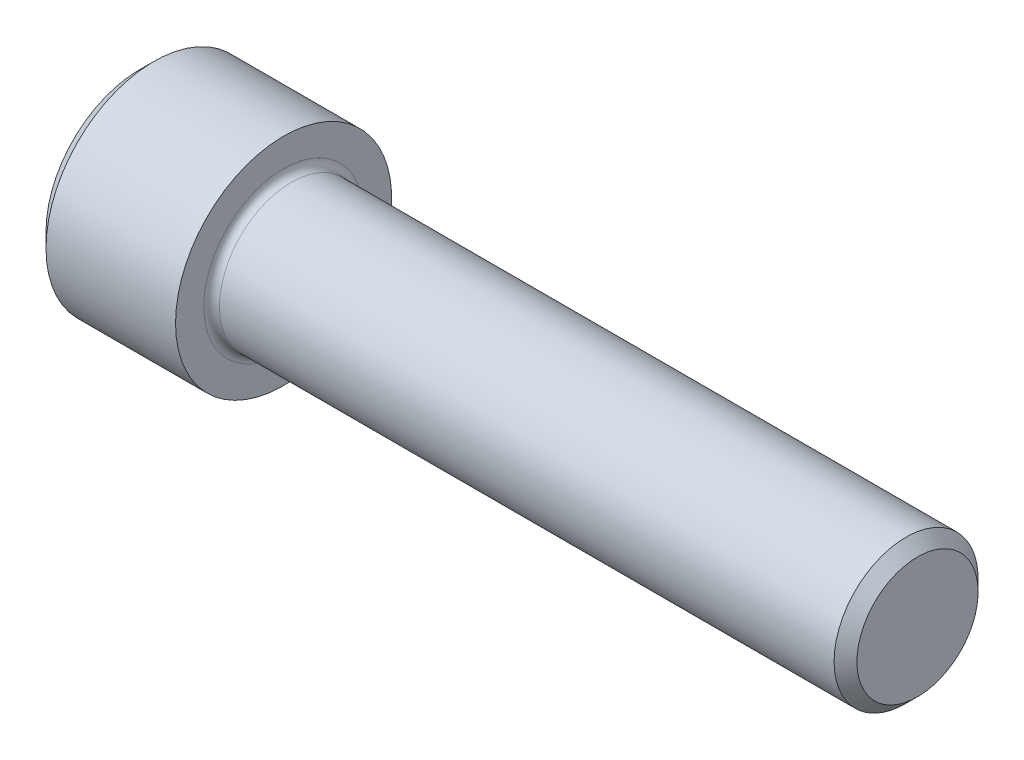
SolidWorks part; units mm, degrees
ref_plane "Plane1" through (0, 0, 0) normal (0, 0, 1) x (1, 0, 0)
ref_plane "Plane2" through (0, 0, 0) normal (0, 1, 0) x (1, 0, 0)
ref_plane "Plane3" through (0, 0, 0) normal (1, 0, 0) x (0, 0, -1)
sketch "BodySke" plane through (0, 0, 0) normal (0, 0, 1) x (1, 0, 0)
  line L0 (0, 0) -> (0, 5.1537)
  line L1 (0.8001, 5.9538) -> (7.9375, 5.9538)
  line L2 (7.9375, 5.9538) -> (7.9375, 3.9688)
  line L3 (7.9375, 3.9688) -> (42.2326, 3.9688)
  line L4 (42.8625, 3.3388) -> (42.8625, 0)
  line L5 (42.8625, 0) -> (0, 0)
  line L6 (-31.75, 0) -> (127, 0) construction
  line L7 (0, 5.1537) -> (0.8001, 5.9538)
  line L8 (42.8625, 3.3388) -> (42.2326, 3.9688)
  line L9 (0, -5.1537) -> (0.8001, -5.9538) construction
  line L10 (42.8625, -3.3388) -> (42.2326, -3.9688) construction
  line L11 (8.9967, 9.525) -> (8.9967, 3.175) construction
  line L12 (7.9375, 9.525) -> (7.9375, 3.175) construction
  line L13 (4.7625, 9.525) -> (4.7625, 3.175) construction
  dimension "Diameter" = 7.9375
  dimension "Head_ht" = 7.9375
  dimension "Length" = 34.925
  dimension "Body_ch_ang" = 45
  dimension "Head_dia" = 11.9075
  dimension "Head_ch_ang" = 45
  dimension "Head_side_ht" = 7.1374
  dimension "Minor_dia" = 6.6777
  dimension "Advance" = 1.0592
  dimension "Thread_nom" = 34.925
  dimension "Thread_length" = 38.1
revolve "Base-Revolve" add sketch "BodySke"
fillet "Fillet1" radius 0.4318 1 edges at (7.9375, 0, 3.9688)
sketch "Sketch2" plane through (0, 0, 0) normal (0, 0, 1) x (1, 0, 0)
  line L0 (0, 3.175) -> (3.8354, 3.175)
  line L1 (3.8354, 3.175) -> (5.6685, 0)
  line L2 (-31.75, 0) -> (127, 0) construction
  line L3 (5.6685, 0) -> (0, 0)
  line L4 (0, 0) -> (0, 3.175)
  line L5 (0, 5.1537) -> (0, -5.1537) construction
  line L6 (0, 0) -> (47.625, 0) construction
  line L7 (7.9375, -5.9538) -> (7.9375, 5.9538) construction
  dimension "D1" = 3.175
  dimension "D2" = 60
  dimension "Wall_thickness" = 4.1021
revolve "Hex-PreBroach" cut sketch "Sketch2" angle 360 about L6
sketch "Sketch3" plane through (0, 0, 0) normal (-1, 0, 0) x (0, 0.5, 0.866)
  line L0 (1.8331, 3.175) -> (-1.8331, 3.175)
  line L1 (-1.8331, 3.175) -> (-3.6662, 0)
  line L2 (1.8331, 3.175) -> (3.6662, 0)
  line L3 (1.8331, -3.175) -> (3.6662, 0)
  line L4 (1.8331, -3.175) -> (-1.8331, -3.175)
  line L5 (-1.8331, -3.175) -> (-3.6662, 0)
  dimension "D1" = 3.175
  dimension "D2" = 3.175
  dimension "Hex_size" = 6.35
extrude "Hex" cut sketch "Sketch3" against normal blind 3.8354
sketch "Sketch4" plane through (0, 0, 0) normal (-1, 0, 0) x (0, 0, 1)
  line L0 (0, 0) -> (3.7846, 0)
  line L1 (0, 0) -> (6.1484, 3.5498) construction
  line L2 (0, 0) -> (1.8923, 3.2776)
  line L3 (3.1235, 0.8061) -> (3.6229, 1.0945)
  line L4 (2.2599, 2.3019) -> (2.7593, 2.5903)
  arc A0 (3.1235, 0.8061) -> (2.2599, 2.3019) centre (0, 0) ccw
  arc A1 (3.7846, 0) -> (3.6229, 1.0945) centre (0, 0) ccw
  arc A2 (1.8923, 3.2776) -> (2.7593, 2.5903) centre (0, 0) cw
  dimension "D1" = 30
  dimension "Spline_n_dim" = 6.4516
  dimension "Spline_m_dim" = 7.5692
  dimension "D2" = 60
  dimension "D3" = 0.8636
  dimension "Spline_p_dim" = 1.7272
extrude "Spline" [suppressed] cut sketch "Sketch4" against normal blind 3.8354
pattern_circular "CirPattern1" [suppressed] count 6 every 60
sketch "Sketch5" plane through (0, 0, 0) normal (0, 0, 1) x (1, 0, 0)
  line L0 (-31.75, 0) -> (127, 0) construction
  line L2 (0, 5.1537) -> (0, -5.1537) construction
  circle A0 centre (2.6416, 0) radius 0.5905
  dimension "Drilled_hole_dia" = 1.1811
  dimension "Drilled_hole_loc" = 2.6416
extrude "Hole" [suppressed] cut sketch "Sketch5" against normal through all and the other way through all
pattern_circular "Drilled-4" [suppressed] count 2 every 60
pattern_circular "Drilled-6" [suppressed] count 3 every 60
sketch "ThdSchSke" plane through (0, 0, 0) normal (0, 0, 1) x (1, 0, 0)
  line L0 (8.9967, -3.3388) -> (8.5556, -3.9688)
  line L1 (8.9967, -3.3388) -> (9.4378, -3.9688)
  line L2 (9.4378, -3.9688) -> (9.4378, -4.9609)
  line L3 (-3.175, 0) -> (5.1513, 0) construction
  line L5 (9.4378, -4.9609) -> (8.5556, -4.9609)
  line L6 (8.5556, -4.9609) -> (8.5556, -3.9688)
  line L7 (0, 5.1537) -> (0, -5.1537) construction
  dimension "Thread_minor" = 6.6777
  dimension "Diameter" = 7.9375
  dimension "Start" = 8.9967
  dimension "SideAngle" = 55
  dimension "VeeAngle" = 70
  dimension "Overcut" = 9.9219
revolve "ThreadSchematic" [suppressed] cut sketch "ThdSchSke" angle 360 about L3
pattern_linear "ThdSchPat" [suppressed]
equation "\"D2@Sketch3\" = \"Hex_size@Sketch3\" / 2"
equation "\"D1@Sketch3\" = \"Hex_size@Sketch3\" / 2"
equation "\"D1@Sketch2\" = \"Hex_size@Sketch3\" / 2"
equation "\"D3@Sketch4\" = \"Spline_p_dim@Sketch4\" / 2"
equation "\"Thread_minor@ThreadCosmetic\"  =  \"Minor_dia@BodySke\""
equation "\"D2@CirPattern1\" = 360 / \"Num_teeth@CirPattern1\""
equation "\"Wall_thickness@Sketch2\" = \"Head_ht@BodySke\" - \"Key_eng@Hex\""
equation "\"Thread_length@ThreadCosmetic\" = ((sgn( (\"Length@BodySke\" - \"Advance@BodySke\" ) - \"Thread_nom@BodySke\" )-1)*( (\"Length@BodySke\" - \"Advance@BodySke\" ) - \"Thread_nom@BodySke\" ))/-2+ \"Thread_nom@BodySke\""
equation "\"Thread_minor@ThdSchSke\" = \"Minor_dia@BodySke\""
equation "\"Diameter@ThdSchSke\" = \"Diameter@BodySke\""
equation "\"Overcut@ThdSchSke\" = \"Diameter@BodySke\" * 1.25"
equation "\"Start@ThdSchSke\" = \"Head_ht@BodySke\" + \"Length@BodySke\" - \"Thread_length@ThreadCosmetic\"  '---Non-countersunk---"
equation "\"Num_threads@ThdSchPat\" = int( \"Thread_length@ThreadCosmetic\" / \"Advance@BodySke\" + 0.999 )  + 1"
equation "\"Advance@ThdSchPat\" = \"Thread_length@ThreadCosmetic\" /  (\"Num_threads@ThdSchPat\" - 1) 'relax it"
equation "\"Num_threads@ThdSchPat\" = \"Num_threads@ThdSchPat\" - sgn( \"Num_threads@ThdSchPat\" - 1) '---chamfered tips only---"
